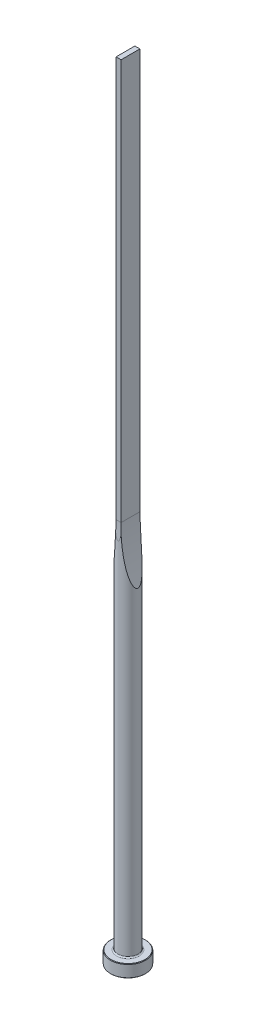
SolidWorks part; units mm, degrees
ref_plane "Front Plane" through (0, 0, 0) normal (0, 0, 1) x (1, 0, 0)
ref_plane "Top Plane" through (0, 0, 0) normal (0, 1, 0) x (1, 0, 0)
ref_plane "Right Plane" through (0, 0, 0) normal (1, 0, 0) x (0, 0, -1)
sketch "Sketch1" plane through (0, 0, 0) normal (0, 0, 1) x (1, 0, 0)
  line L0 (0, 0) -> (6.8, 0)
  line L1 (55, 0) -> (-55, 0) construction
  line L2 (7, 0.2) -> (7, 4.8)
  line L3 (6.8, 5) -> (4.5, 5)
  line L4 (4, 5.5) -> (4, 315)
  line L5 (0, 315) -> (4, 315)
  line L6 (7, 4.8) -> (6.8, 5)
  line L7 (6.8, 0) -> (7, 0.2)
  line L8 (0, 315) -> (0, 0)
  arc A0 (4, 5.5) -> (4.5, 5) centre (4.5, 5.5) ccw
  point P1 (7, 0)
  point P6 (7, 5)
  dimension "D4" = 0.5
  dimension "D1" = 4
  dimension "D2" = 7
  dimension "D3" = 5
  dimension "D5" = 315
revolve "Revolve1" add sketch "Sketch1" angle 360 about L8
sketch "Sketch2" plane through (0, 0, 0) normal (0, 0, 1) x (1, 0, 0)
  line L0 (1, 315) -> (1, 155)
  line L1 (4, 315) -> (-4, 315) construction
  line L2 (-1, 315) -> (-1, 155)
  line L3 (4, 315) -> (4, 131.9566)
  line L4 (-4, 315) -> (-4, 131.9566)
  line L5 (0, -7.7) -> (0, 7.7) construction
  line L6 (4, 315) -> (1, 315)
  line L8 (-1, 315) -> (-4, 315)
  arc A0 (1, 155) -> (4, 131.9566) centre (91, 155) ccw
  arc A1 (-1, 155) -> (-4, 131.9566) centre (-91, 155) cw
  dimension "D4" = 90
  dimension "D1" = 160
  dimension "D2" = 2
  dimension "D3" = 1
extrude "Cut-Extrude1" cut sketch "Sketch2" against normal mid plane 10
sketch "Sketch3" plane through (0, 0, 0) normal (1, 0, 0) x (0, 0, -1)
  line L0 (3.75, 315) -> (3.75, 155)
  line L1 (-3.873, 315) -> (3.873, 315) construction
  line L2 (-3.75, 315) -> (-3.75, 155)
  line L3 (4, 315) -> (4, 148.2965)
  line L4 (3.75, 315) -> (4, 315)
  line L5 (0, 7.7) -> (0, -7.7) construction
  line L6 (-4, 315) -> (-4, 148.2965)
  line L8 (-3.75, 315) -> (-4, 315)
  arc A0 (3.75, 155) -> (4, 148.2965) centre (93.75, 155) ccw
  arc A1 (-3.75, 155) -> (-4, 148.2965) centre (-93.75, 155) cw
  dimension "D2" = 90
  dimension "D1" = 160
  dimension "D3" = 7.5
  dimension "D4" = 3.75
extrude "Cut-Extrude2" cut sketch "Sketch3" against normal mid plane 10
